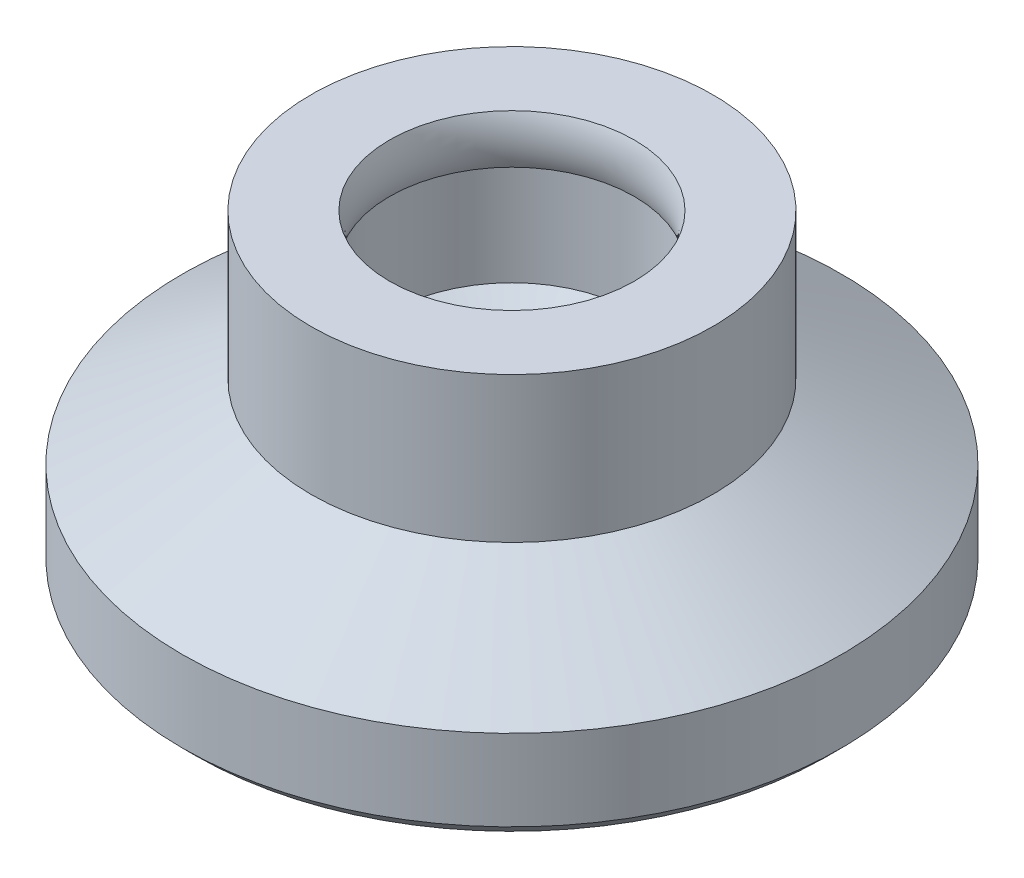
SolidWorks part; units mm, degrees
ref_plane "Front Plane" through (0, 0, 0) normal (0, 0, 1) x (1, 0, 0)
ref_plane "Top Plane" through (0, 0, 0) normal (0, 1, 0) x (1, 0, 0)
ref_plane "Right Plane" through (0, 0, 0) normal (1, 0, 0) x (0, 0, -1)
sketch "Sketch1" plane through (0, 0, 0) normal (0, 1, 0) x (1, 0, 0)
  circle A0 centre (0, 0) radius 6.4
  dimension "D1" = 12.8
extrude "Extrude1" add sketch "Sketch1" along normal mid plane 10
sketch "Sketch3" plane through (0, -5, 0) normal (0, -1, 0) x (1, 0, 0)
  circle A0 centre (0, 0) radius 10.5
  dimension "D1" = 21
extrude "Extrude2" add sketch "Sketch3" against normal blind 3
sketch "Sketch4" plane through (0, 0, 0) normal (0, 0, 1) x (1, 0, 0)
  line L0 (-10.5, -2) -> (-6.4, 0.3671)
  line L1 (-6.4, 5) -> (-6.4, -2) construction
  line L2 (-6.4, 0.3671) -> (-6.4, -2)
  line L3 (-6.4, -2) -> (-10.5, -2)
  dimension "D1" = 30
revolve "Revolve1" add sketch "Sketch4" angle 360 about axis through (0, 5, 0) along (0, -1, 0)
chamfer "Chamfer1" distance 0.42 angle 45 1 edges at (0, -5, -10.5)
sketch "Sketch5" plane through (0, 0, 0) normal (0, 0, 1) x (1, 0, 0)
  line L1 (0, 0) -> (0, 11.3083) construction
  line L2 (0, 5) -> (3.9, 5)
  line L3 (6.4, 5) -> (-6.4, 5) construction
  line L4 (3.9, 3.44) -> (3.9, 0.2517)
  line L5 (3.9, 0.2517) -> (0, -2)
  line L6 (0, -2) -> (0, 5)
  line L7 (10.5, -2) -> (-10.5, -2) construction
  arc A0 (3.9, 5) -> (3.9, 3.44) centre (5.772, 4.22) ccw
  point P14 (3.744, 4.22)
  dimension "D2" = 7.8
  dimension "D1" = 60
  dimension "D3" = 1.56
  dimension "D4" = 0.156
revolve "Cut-Revolve1" cut sketch "Sketch5" angle 360 about L1
equation "\"D3@Sketch5\" = \"D2@Sketch5\"*0.2"
equation "\"D4@Sketch5\" = \"D3@Sketch5\"*0.1"
